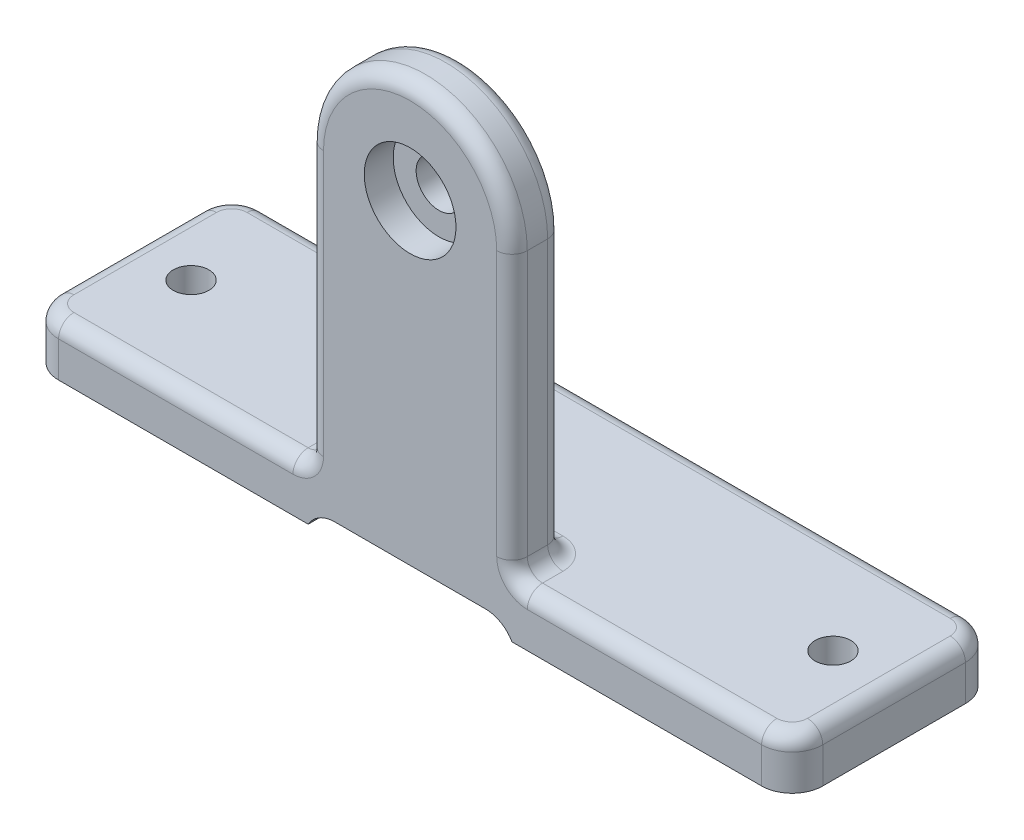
SolidWorks part; units mm, degrees
ref_plane "Front Plane" through (0, 0, 0) normal (0, 0, 1) x (1, 0, 0)
ref_plane "Top Plane" through (0, 0, 0) normal (0, 1, 0) x (1, 0, 0)
ref_plane "Right Plane" through (0, 0, 0) normal (1, 0, 0) x (0, 0, -1)
sketch "Sketch1" plane through (0, 0, 0) normal (0, 1, 0) x (1, 0, 0)
  line L1 (0, 0) -> (150, 0)
  line L2 (0, 0) -> (0, 40)
  line L3 (0, 40) -> (150, 40)
  line L4 (150, 0) -> (150, 40)
  dimension "D1" = 150
  dimension "D2" = 40
extrude "Base Plate" add sketch "Sketch1" along normal blind 10
sketch "Sketch2" plane through (0, 0, 0) normal (0, 0, 1) x (1, 0, 0)
  line L0 (55, 0) -> (55, 65)
  line L1 (0, 0) -> (150, 0) construction
  line L2 (95, 65) -> (95, 0)
  line L3 (95, 0) -> (55, 0)
  line L4 (0, 10) -> (0, 0) construction
  arc A0 (55, 65) -> (95, 65) centre (75, 65) cw
  dimension "D1" = 20
  dimension "D2" = 75
  dimension "D3" = 65
extrude "Vert Boss" add sketch "Sketch2" against normal blind 10
sketch "Sketch5" plane through (0, 0, 0) normal (0, 0, 1) x (1, 0, 0)
  line L0 (0, 0) -> (150, 0) construction
  line L1 (55, 0) -> (95, 0)
  line L2 (55, 0) -> (55, 3)
  line L3 (55, 3) -> (95, 3)
  line L4 (95, 0) -> (95, 3)
  line L5 (55, 65) -> (55, 10) construction
  line L6 (95, 10) -> (95, 65) construction
  dimension "D1" = 3
extrude "Slot" cut sketch "Sketch5" against normal through all
hole_wizard "Ø7.0 (7) Diameter Hole1" positions "Sketch9" profile "Sketch8" hole size "Ø7.0" standard "Ansi Metric"
sketch "Sketch9" plane through (0, 10, 0) normal (0, 1, 0) x (-1, 0, 0)
  line L0 (-150, 0) -> (-150, -40) construction
  line L1 (-150, -40) -> (0, -40) construction
  line L2 (0, -40) -> (0, 0) construction
  point P0 (-138, -20)
  point P1 (-12, -20)
  dimension "D1" = 12
  dimension "D2" = 20
  dimension "D3" = 12
sketch "Sketch8" plane through (138, 10, -20) normal (1, 0, 0) x (0, 0, 1)
  line L0 (0, 0) -> (0, 10)
  line L1 (0, 10) -> (3.5, 10)
  line L2 (3.5, 10) -> (3.5, 0)
  line L5 (3.5, 0) -> (0, 0)
  line L11 (0, -6.35) -> (0, 107.95) construction
  dimension "Thru Hole Dia." = 7
  dimension "Thru Hole Depth" = 10
hole_wizard "CBORE for M8 Hex Head Bolt1" positions "Sketch4" profile "Sketch3" counterbore size "M8" standard "Ansi Metric"
sketch "Sketch4" plane through (0, 0, 0) normal (0, 0, 1) x (1, 0, 0)
  point P0 (75, 65)
sketch "Sketch3" plane through (75, 65, 0) normal (1, 0, 0) x (0, -1, 0)
  line L0 (0, 0) -> (0, 40)
  line L1 (0, 40) -> (4.5, 40)
  line L3 (4.5, 40) -> (4.5, 5.68)
  line L4 (4.5, 5.68) -> (9.005, 5.68)
  line L5 (9.005, 5.68) -> (9.005, 0)
  line L7 (9.005, 0) -> (0, 0)
  line L11 (0, -6.35) -> (0, 107.95) construction
  dimension "Thru Hole Dia." = 9
  dimension "Thru Hole Depth" = 40
  dimension "C'Bore Dia." = 18.01
  dimension "C'Bore Depth" = 5.68
fillet "Fillet1" radius 6 6 edges at (95, 3, -20) (55, 3, -20) (0, 5, 0) (0, 5, -40) (150, 5, -40) (150, 5, 0)
fillet "Fillet2" radius 3 18 edges at (1.7574, 10, -38.2426) (0, 10, -20) (75, 10, -40) (1.7574, 10, -1.7574) (148.2426, 10, -38.2426) (30.5, 10, 0) (150, 10, -20) (55, 10, -5) (148.2426, 10, -1.7574) (75, 10, -10) (119.5, 10, 0) (95, 37.5, -10) (55, 37.5, -10) (95, 37.5, 0) (55, 37.5, 0) (95, 10, -5) (75, 85, -10) (75, 85, 0)
